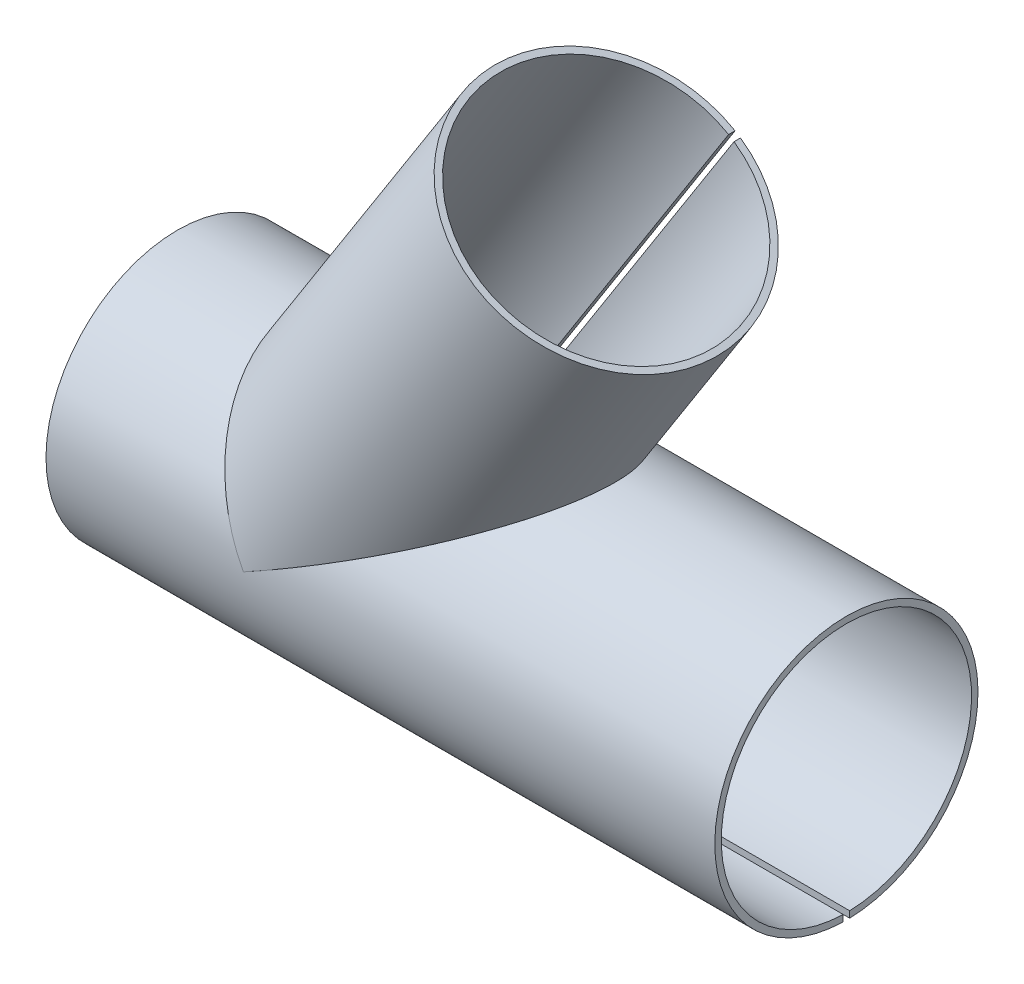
SolidWorks part; units mm, degrees
ref_plane "前视基准面" through (0, 0, 0) normal (0, 0, 1) x (1, 0, 0)
ref_plane "上视基准面" through (0, 0, 0) normal (0, 1, 0) x (1, 0, 0)
ref_plane "右视基准面" through (0, 0, 0) normal (1, 0, 0) x (0, 0, -1)
sketch "草图1" plane through (0, 0, 0) normal (0, 0, 1) x (1, 0, 0)
  line L0 (-30.5416, 0) -> (72.9721, 0) construction
  line L1 (0, 0) -> (35.7984, 56.1785) construction
  line L2 (72.9721, 20.3684) -> (72.9721, -20.3684) construction
  line L3 (18.6211, 67.1243) -> (52.9757, 45.2327) construction
  line L4 (52.9757, 45.2327) -> (37.1315, 20.3684) construction
  line L5 (37.1315, 20.3684) -> (72.9721, 20.3684) construction
  line L6 (18.6211, 67.1243) -> (-11.173, 20.3684) construction
  line L7 (-11.173, 20.3684) -> (-30.5416, 20.3684) construction
  line L8 (-30.5416, 20.3684) -> (-30.5416, -20.3684) construction
  line L9 (0, 0) -> (0, -1) construction
  line L10 (-11.173, 20.3684) -> (0, 0) construction
  line L11 (0, 0) -> (37.1315, 20.3684) construction
  line L12 (-11.173, 20.3684) -> (-11.173, 19.3684) construction
  line L13 (0, 0) -> (35.7984, 56.1785)
  dimension "L3" = 103.5137
  dimension "R" = 20.3684
  dimension "L1" = 66.6149
  dimension "L2" = 19.3686
  dimension "B" = 57.494
  dimension "t" = 1
sketch "草图2" plane through (0, 0, 0) normal (1, 0, 0) x (0, 0, -1)
  circle A0 centre (0, 0) radius 20.3684
extrude "拉伸-薄壁1" add sketch "草图2" along normal up to vertex and the other way up to vertex thin
ref_plane "基准面1" through (35.7984, 56.1785, 0) normal (0.5374, 0.8433, 0) x (-0.8433, 0.5374, 0)
sketch "草图3" plane through (35.7984, 56.1785, 0) normal (0.5374, 0.8433, 0) x (-0.8433, 0.5374, 0)
  circle A0 centre (0, 0) radius 20.3684
extrude "拉伸-薄壁2" add sketch "草图3" against normal up to vertex separate body thin
sketch "草图4" plane through (0, 0, 0) normal (0, 0, 1) x (1, 0, 0)
  line L0 (-11.173, 20.3684) -> (0, 0)
  line L1 (0, 0) -> (37.1315, 20.3684)
  line L2 (37.1315, 20.3684) -> (-11.173, 20.3684)
extrude "切除-拉伸1" cut sketch "草图4" against normal through all and the other way through all
sketch "草图5" plane through (0, 0, 0) normal (0, 0, 1) x (1, 0, 0)
  line L0 (52.9757, 45.2327) -> (37.1315, 20.3684) construction
  line L1 (18.6211, 67.1243) -> (52.9757, 45.2327) construction
  line L2 (18.6211, 67.1243) -> (-11.173, 20.3684) construction
  line L3 (-11.173, 20.3684) -> (0, 0) construction
  line L4 (0, 0) -> (37.1315, 20.3684) construction
  line L5 (52.9757, 45.2327) -> (37.1315, 20.3684)
  line L6 (18.6211, 67.1243) -> (52.9757, 45.2327)
  line L7 (18.6211, 67.1243) -> (-11.173, 20.3684)
  line L8 (-11.173, 20.3684) -> (0, 0)
  line L9 (0, 0) -> (37.1315, 20.3684)
extrude "切除-拉伸2" cut sketch "草图5" against normal through all and the other way through all flip side to cut
sketch "草图6" plane through (0, 0, 0) normal (0, 1, 0) x (1, 0, 0)
  line L0 (-30.5416, 0) -> (72.9721, 0)
extrude "切除-拉伸-薄壁1" cut sketch "草图6" against normal through all thin
extrude "切除-拉伸-薄壁2" cut sketch "草图1" against normal through all thin
equation "\"D5@拉伸-薄壁1\" = \"t@草图1\""
equation "\"D5@拉伸-薄壁2\" = \"t@草图1\""
